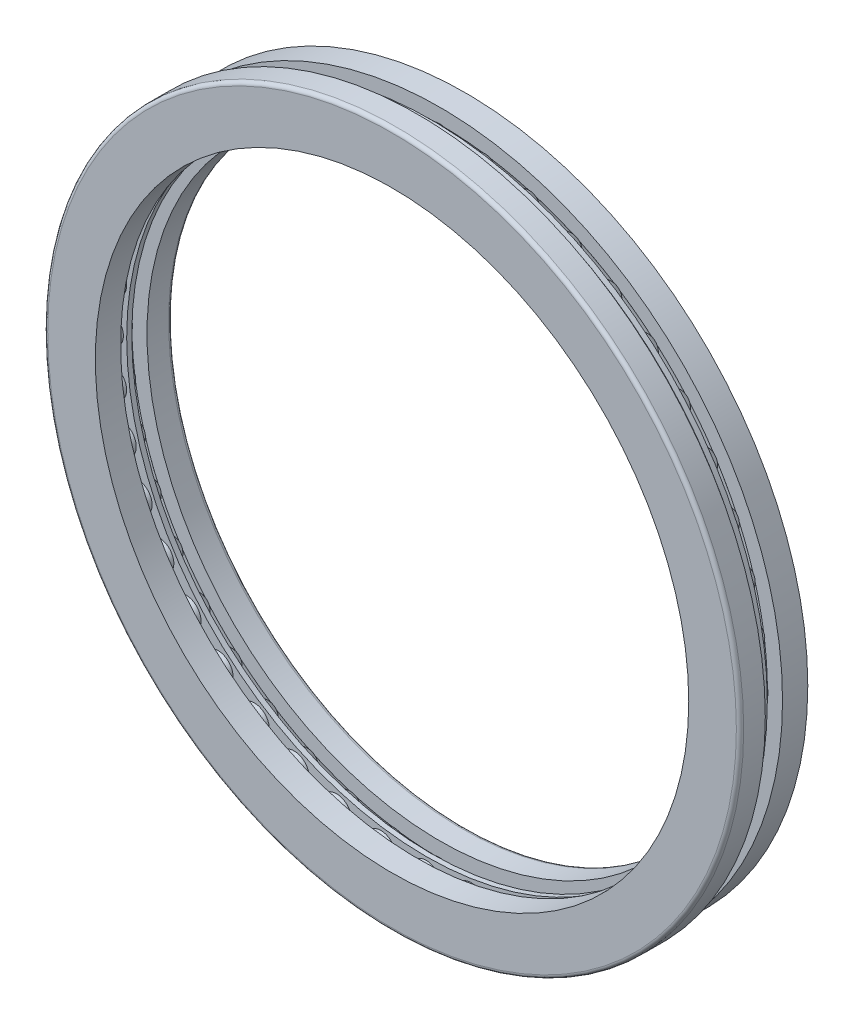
SolidWorks part; units mm, degrees
ref_plane "Front Plane" through (0, 0, 0) normal (0, 0, 1) x (1, 0, 0)
ref_plane "Top Plane" through (0, 0, 0) normal (0, 1, 0) x (1, 0, 0)
ref_plane "Right Plane" through (0, 0, 0) normal (1, 0, 0) x (0, 0, -1)
other "Configuration Table"
sketch "BaseSke" plane through (0, 0, 0) normal (1, 0, 0) x (0, 0, -1)
  line L0 (-22.7078, 0) -> (24.6132, 0) construction
  line L1 (-22.7078, 43.375) -> (24.6132, 43.375) construction
  line L2 (0, 129.5214) -> (0, -86.3012) construction
  line L3 (0, 45.4583) -> (0, 41.2917)
  line L6 (-5, 47.5) -> (-5, 40.5) construction
  line L8 (5, 46.75) -> (5, 40) construction
  arc A0 (0, 45.4583) -> (0, 41.2917) centre (0, 43.375) ccw
revolve "Ball" add sketch "BaseSke" angle 360 about L3
sketch "InnerRaceSke" plane through (0, 0, 0) normal (1, 0, 0) x (0, 0, -1)
  line L0 (1.5517, 42.061) -> (1.5517, 40)
  line L1 (1.5517, 46.75) -> (5, 46.75)
  line L2 (1.5517, 46.75) -> (1.5517, 44.689)
  line L3 (1.5517, 40) -> (5, 40)
  line L4 (5, 46.75) -> (5, 40)
  line L5 (-18.959, 0) -> (19.5136, 0) construction
  arc A0 (1.5517, 42.061) -> (1.5517, 44.689) centre (0, 43.375) ccw
  arc A2 (0, 45.4583) -> (0, 41.2917) centre (0, 43.375) ccw construction
revolve "InnerRace" add sketch "InnerRaceSke" angle 360 about L5
sketch "OuterRaceSke" plane through (0, 0, 0) normal (1, 0, 0) x (0, 0, -1)
  line L0 (-1.5517, 42.061) -> (-1.5517, 40.5)
  line L1 (-5, 47.5) -> (-1.5517, 47.5)
  line L2 (-5, 47.5) -> (-5, 40.5)
  line L3 (-5, 40.5) -> (-1.5517, 40.5)
  line L4 (-1.5517, 47.5) -> (-1.5517, 44.689)
  line L5 (-27.1643, 0) -> (37.3715, 0) construction
  arc A0 (-1.5517, 44.689) -> (-1.5517, 42.061) centre (0, 43.375) ccw
  arc A1 (0, 45.4583) -> (0, 41.2917) centre (0, 43.375) ccw construction
revolve "OuterRace" add sketch "OuterRaceSke" angle 360 about L5
fillet "Fillet1" radius 0.5 2 edges at (47.5, 0, 5) (40, 0, -5)
pattern_circular "CirPatternBall" count 44 over 360 about axis through (0, 0, 0) along (0, 0, 1) of "Ball"
sketch "CageSke" plane through (0, 0, 0) normal (1, 0, 0) x (0, 0, -1)
  line L0 (0, 59.1614) -> (0, 0) construction
  line L1 (0.3472, 45.875) -> (-0.3472, 45.875)
  line L2 (0.3472, 45.875) -> (0.3472, 40.875)
  line L3 (0.3472, 40.875) -> (-0.3472, 40.875)
  line L4 (-0.3472, 45.875) -> (-0.3472, 40.875)
  line L5 (-23.077, 0) -> (28.998, 0) construction
  circle A0 centre (0, 43.375) radius 2.524 construction
  arc A1 (0, 45.4583) -> (0, 41.2917) centre (0, 43.375) ccw construction
revolve "Cage" add sketch "CageSke" angle 360 about L5
sketch "SimplifiedSke" plane through (0, 0, 0) normal (1, 0, 0) x (0, 0, -1)
  line L0 (-32.3536, 0) -> (41.9236, 0) construction
  circle A0 centre (0, 43.375) radius 2.0833
  arc A1 (0, 45.4583) -> (0, 41.2917) centre (0, 43.375) ccw construction
revolve "Simplified" [suppressed] add sketch "SimplifiedSke" angle 360 about L0
equation "\"Diameter2@BaseSke\" =  int(  \"Bearing_Outside_Diameter@BaseSke\" * 0.98 )  + 0.5"
equation "\"Diameter1@BaseSke\" =  int(  \"Bearing_Inside_Diameter@BaseSke\"  * 1.002)  + 1"
equation "\"D2@BaseSke\" = \"Bearing_Thickness@BaseSke\"/2"
equation "\"D1@BaseSke\" =  ( \"Diameter2@BaseSke\" + \"Bearing_Inside_Diameter@BaseSke\" )  / 4"
equation "\"Ball_diameter@BaseSke\" = \"Bearing_Thickness@BaseSke\"  / 2.4"
equation "\"D1@InnerRaceSke\" = \"Ball_diameter@BaseSke\"-0.02-\"Bearing_Inside_Diameter@BaseSke\"*0.001"
equation "\"D2@InnerRaceSke\" = \"Bearing_Thickness@BaseSke\"/2.9"
equation "\"D1@OuterRaceSke\" = \"Ball_diameter@BaseSke\"-0.02-\"Bearing_Inside_Diameter@BaseSke\"*0.001"
equation "\"D2@OuterRaceSke\" = \"Bearing_Thickness@BaseSke\" / 2.9"
equation "\"D1@CirPatternBall\" =  pi  * \"D1@BaseSke\" * 2 / \"Ball_diameter@BaseSke\"/1.5"
equation "\"D1@CageSke\" = \"Ball_diameter@BaseSke\"/6"
equation "\"D2@CageSke\" = \"Ball_diameter@BaseSke\" * 1.2"
